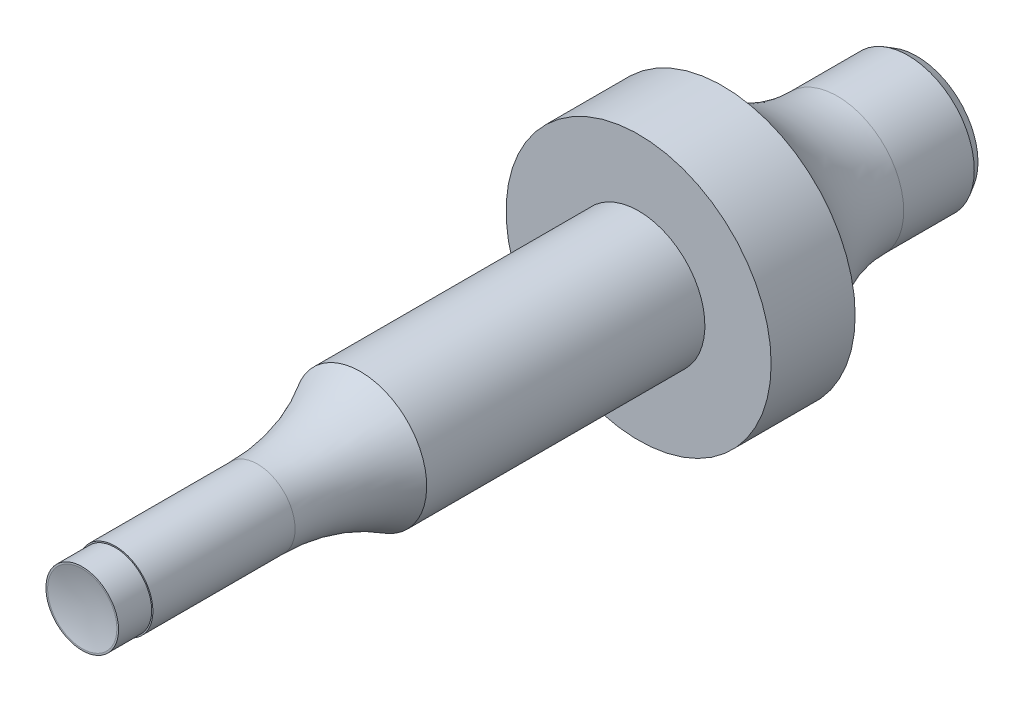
SolidWorks part; units mm, degrees
ref_plane "Front Plane" through (0, 0, 0) normal (0, 0, 1) x (1, 0, 0)
ref_plane "Top Plane" through (0, 0, 0) normal (0, 1, 0) x (1, 0, 0)
ref_plane "Right Plane" through (0, 0, 0) normal (1, 0, 0) x (0, 0, -1)
sketch "Sketch1" plane through (0, 0, 0) normal (0, 0, 1) x (1, 0, 0)
  circle A0 centre (0, 0) radius 7.94
  dimension "D1" = 15.88
extrude "Boss-Extrude1" add sketch "Sketch1" against normal blind 100
sketch "Sketch2" plane through (0, 0, 0) normal (0, 0, 1) x (1, 0, 0)
  circle A0 centre (0, 0) radius 4.5
  dimension "D1" = 9
extrude "Cut-Extrude1" cut sketch "Sketch2" against normal blind 33.3333 flip side to cut
sketch "Sketch3" plane through (0, 0, 0) normal (0, 0, 1) x (1, 0, 0)
  circle A0 centre (0, 0) radius 4.35
  dimension "D1" = 8.7
extrude "Cut-Extrude2" cut sketch "Sketch3" against normal blind 3.97 flip side to cut
sketch "Sketch4" plane through (0, 0, 0) normal (1, 0, 0) x (0, 0, -1)
  line L0 (0, 0) -> (0, 4.15)
  line L1 (0, 4.35) -> (0, -4.35) construction
  line L2 (0.5519, 0) -> (0.5519, 4.15) construction
  line L3 (0, 0) -> (0.5519, 0)
  line L4 (0, 0) -> (0, -4.15) construction
  arc A0 (0.5519, 0) -> (0, 4.15) centre (-15.3281, 0) ccw
  dimension "D2" = 15.88
  dimension "D1" = 8.3
revolve "Cut-Revolve1" cut sketch "Sketch4" angle 360 about L3
chamfer "Chamfer1" distance 1.0587 angle 30 1 edges at (7.94, 0, -100)
sketch "Sketch5" plane through (0, 0, 0) normal (1, 0, 0) x (0, 0, -1)
  line L0 (33.3333, 0) -> (21.0026, 0)
  line L1 (33.3333, 7.94) -> (33.3333, -7.94) construction
  line L2 (21.0026, 0) -> (21.0026, 4.5)
  line L3 (33.3333, 4.5) -> (3.97, 4.5) construction
  line L4 (33.3333, 7.94) -> (33.3333, 0)
  line L5 (21.0026, 4.5) -> (33.3333, 4.5) construction
  arc A0 (21.0026, 4.5) -> (33.3333, 7.94) centre (21.0026, 28.32) ccw
  dimension "D1" = 23.82
revolve "Revolve1" add sketch "Sketch5" angle 360 about L0
sketch "Sketch6" plane through (0, 0, 0) normal (1, 0, 0) x (0, 0, -1)
  line L0 (66.6667, 0) -> (90.4867, 0)
  line L1 (66.6667, 0) -> (66.6667, 15.88)
  line L2 (66.6667, 15.88) -> (76.7342, 15.88)
  line L3 (90.4867, 0) -> (90.4867, 7.94)
  line L4 (98.9413, 7.94) -> (33.3333, 7.94) construction
  line L5 (90.4867, 7.94) -> (66.6667, 7.94) construction
  line L6 (100, -7.94) -> (100, 7.94) construction
  arc A0 (90.4867, 7.94) -> (76.7342, 15.88) centre (90.4867, 23.82) cw
  dimension "D2" = 15.88
  dimension "D1" = 33.3333
  dimension "D3" = 23.82
revolve "Revolve2" add sketch "Sketch6" angle 360 about L0
sketch "Sketch7" plane through (0, 0, -100) normal (0, 0, -1) x (-1, 0, 0)
  line L9 (-13.4386, 3.0549) -> (-7.3288, 3.0549)
  line L10 (-13.4386, 3.0549) -> (-13.4386, -3.0549)
  line L11 (-13.4386, -3.0549) -> (-7.3288, -3.0549)
  line L12 (-7.3288, 3.0549) -> (-7.3288, -3.0549)
  circle A5 centre (0, 0) radius 7.94 construction
  circle A6 centre (0, 0) radius 7.3288 construction
  point P8 (-7.3288, 0)
extrude "Cut-Extrude3" [suppressed] cut sketch "Sketch7" against normal through all
